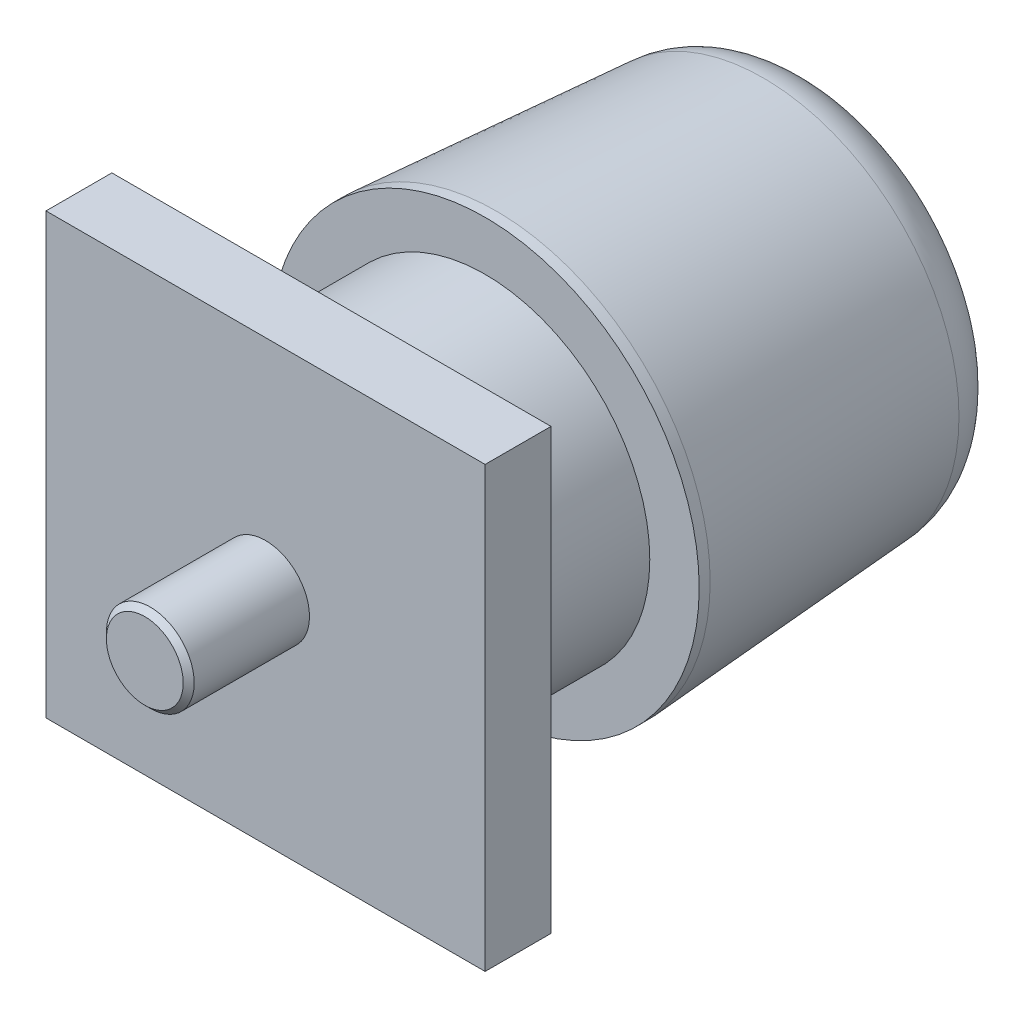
SolidWorks part; units mm, degrees
ref_plane "Face" through (0, 0, 0) normal (0, 0, 1) x (1, 0, 0)
ref_plane "Dessus" through (0, 0, 0) normal (0, 1, 0) x (1, 0, 0)
ref_plane "Droite" through (0, 0, 0) normal (1, 0, 0) x (0, 0, -1)
imported_body "Importée1"
sketch "Esquisse1" plane through (0, 0, 50) normal (0, 0, 1) x (1, 0, 0)
  circle A0 centre (0, 0) radius 4
  dimension "D1" = 8
extrude "Extrusion2" add sketch "Esquisse1" along normal blind 11
chamfer "Chanfrein2" distance 0.5 angle 45
